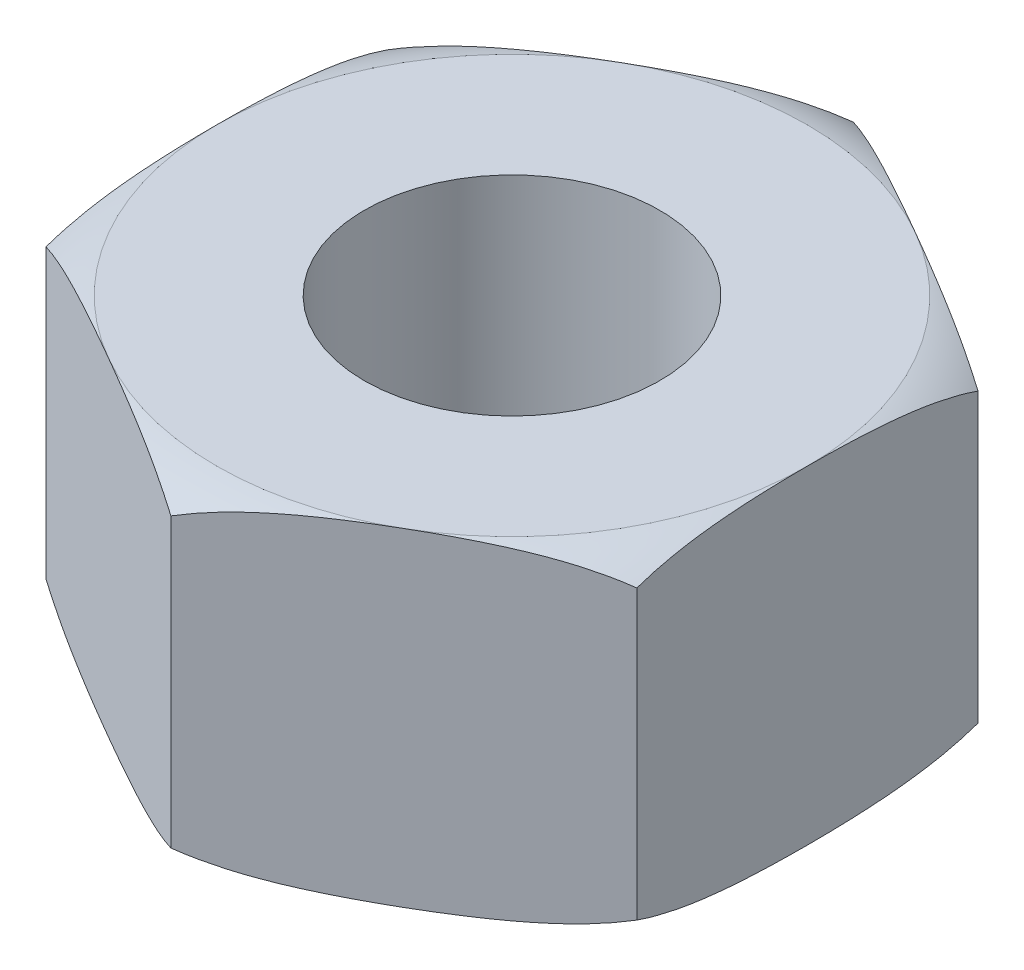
SolidWorks part; units mm, degrees
ref_plane "Front Plane" through (0, 0, 0) normal (0, 0, 1) x (1, 0, 0)
ref_plane "Top Plane" through (0, 0, 0) normal (0, 1, 0) x (1, 0, 0)
ref_plane "Right Plane" through (0, 0, 0) normal (1, 0, 0) x (0, 0, -1)
sketch "Sketch1" plane through (0, 0, 0) normal (0, 1, 0) x (1, 0, 0)
  line L1 (0, 10.3923) -> (-9, 5.1962)
  line L2 (-9, 5.1962) -> (-9, -5.1962)
  line L3 (-9, -5.1962) -> (0, -10.3923)
  line L4 (0, -10.3923) -> (9, -5.1962)
  line L5 (9, -5.1962) -> (9, 5.1962)
  line L6 (9, 5.1962) -> (0, 10.3923)
  circle A0 centre (0, 0) radius 9 construction
  circle A1 centre (0, 0) radius 4.5
  dimension "D1" = 9
  dimension "D2" = 18
extrude "Boss-Extrude1" add sketch "Sketch1" along normal mid plane 10
sketch "Sketch4" plane through (0, 0, 0) normal (0, 0, 1) x (1, 0, 0)
  line L3 (0, 0) -> (0, 5.9505) construction
  line L4 (9, 5) -> (12, 5)
  line L5 (12, 5) -> (12, 2)
  arc A1 (9, 5) -> (12, 2) centre (8.1021, 1.1021) cw
  dimension "D1" = 3
  dimension "D2" = 4
revolve "Cut-Revolve1" cut sketch "Sketch4" angle 360 about L3
mirror "Mirror1" about plane through (0, 0, 0) normal (0, 1, 0) of "Cut-Revolve1"
